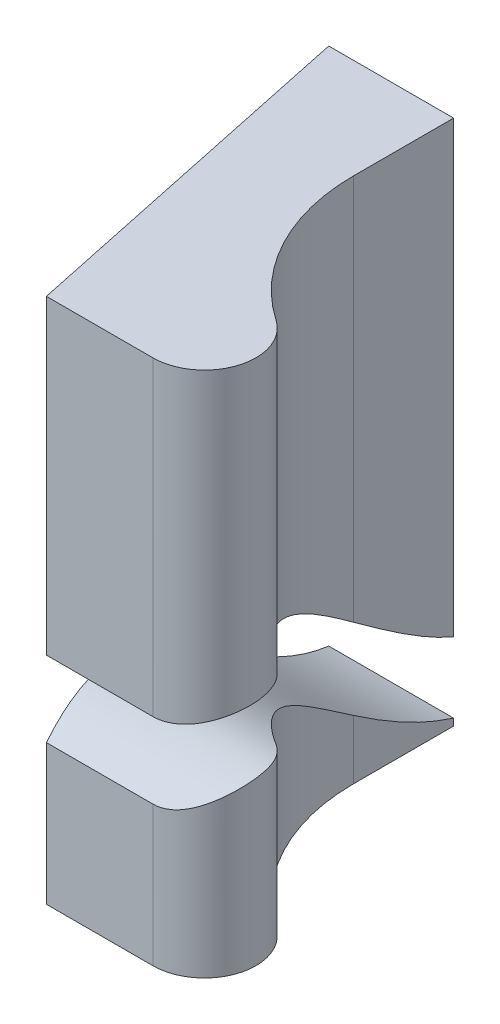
SolidWorks part; units mm, degrees
ref_plane "Front Plane" through (0, 0, 0) normal (0, 0, 1) x (1, 0, 0)
ref_plane "Top Plane" through (0, 0, 0) normal (0, 1, 0) x (1, 0, 0)
ref_plane "Right Plane" through (0, 0, 0) normal (1, 0, 0) x (0, 0, -1)
sketch "Sketch1" plane through (0, 0, 0) normal (1, 0, 0) x (0, 0, -1)
  spline S0 degree 3 poles (-50.2564, -4.6182) (-13.8908, 81.4125) (14.6119, -15.5554) (62.2093, 1.6299) knots 0 0 0 0 1 1 1 1
surface "Surface-Extrude1" sketch "Sketch1" parameters "D1"=101.6
ref_plane "Plane1" through (0, 96.52, 0) normal (0, 1, 0) x (1, 0, 0)
sketch "Sketch2" plane through (0, 96.52, 0) normal (0, 1, 0) x (1, 0, 0)
  line L0 (-22.6573, 42.4703) -> (32.1699, 42.4703)
  line L1 (32.1699, 42.4703) -> (32.1699, 25.8664)
  line L2 (32.1699, 25.8664) -> (19.5441, 25.8664)
  line L3 (17.4686, -34.8413) -> (-7.2642, -34.8413)
  line L4 (-7.2642, -34.8413) -> (-22.6573, 42.4703)
  arc A0 (19.5441, 25.8664) -> (16.085, 7.533) centre (19.5441, 16.3734) ccw
  arc A1 (16.085, 7.533) -> (17.4686, -34.8413) centre (7.6784, -13.9512) cw
surface "Surface-Trim1"
sketch "Sketch3" plane through (0, 0, 0) normal (0, 1, 0) x (1, 0, 0)
  line L0 (-17.4067, 39.3793) -> (-2.8132, -29.6965)
  line L1 (-2.8132, -29.6965) -> (17.7258, -29.6965)
  line L2 (6.688, 20.059) -> (6.688, 39.3793)
  line L3 (6.688, 39.3793) -> (-17.4067, 39.3793)
  arc A0 (17.7258, -29.6965) -> (23.347, -11.5357) centre (17.7258, -19.7462) ccw
  arc A1 (23.347, -11.5357) -> (6.688, 20.059) centre (44.978, 20.059) cw
extrude "Boss-Extrude2" add sketch "Sketch3" along normal blind 101.6
thicken "Cut-Thicken1" surfaces to thicken 102 thickness 12.7 parameters "D1"=12.7
